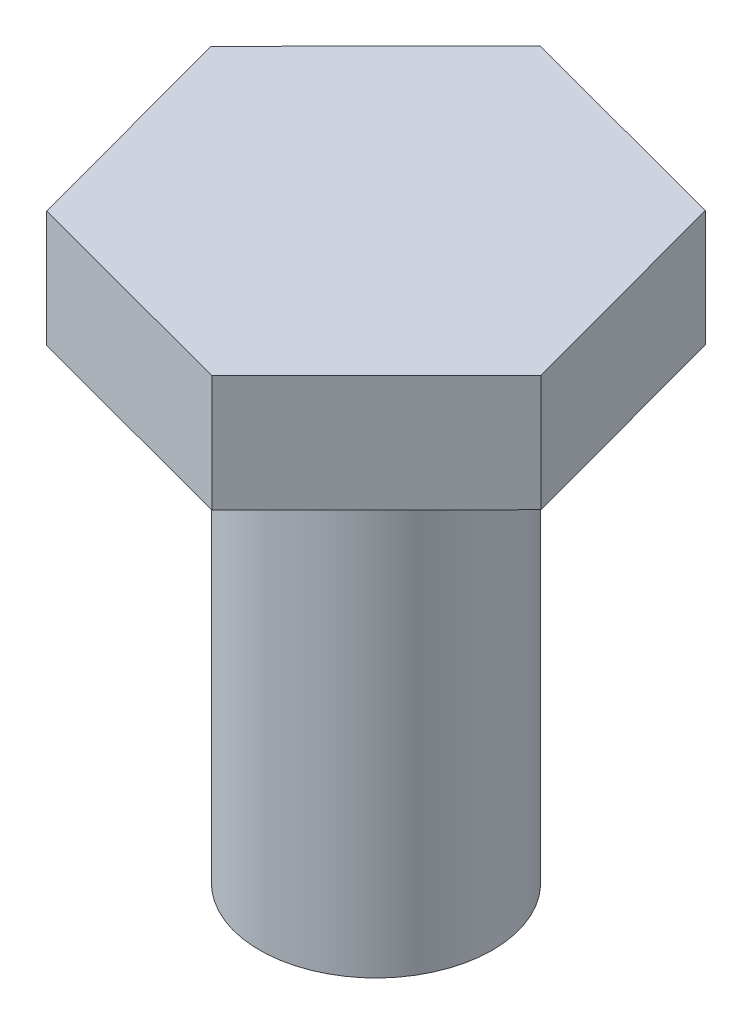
SolidWorks part; units mm, degrees
ref_plane "Front" through (0, 0, 0) normal (0, 0, 1) x (1, 0, 0)
ref_plane "Top" through (0, 0, 0) normal (0, 1, 0) x (1, 0, 0)
ref_plane "Right" through (0, 0, 0) normal (1, 0, 0) x (0, 0, -1)
sketch "Sketch1" plane through (0, 0, 0) normal (0, 0, 1) x (1, 0, 0)
  line L0 (0, 101.3677) -> (0, -91.7136) construction
  line L1 (0, -49.69) -> (25.4, -49.69)
  line L2 (25.4, -49.69) -> (25.4, 51.91)
  line L3 (25.4, 51.91) -> (50.8, 51.91)
  line L4 (50.8, 51.91) -> (50.8, 77.31)
  line L5 (50.8, 77.31) -> (0, 77.31)
  line L6 (0, 77.31) -> (0, -49.69)
  dimension "D1" = 50.8
  dimension "D2" = 101.6
  dimension "D3" = 25.4
  dimension "D4" = 127
revolve "Revolve1" add sketch "Sketch1" angle 360 about L0
sketch "Sketch2" plane through (0, 77.31, 0) normal (0, 1, 0) x (-1, 0, 0)
  line L1 (35.8608, 35.9811) -> (-13.2302, 49.0469)
  line L2 (-13.2302, 49.0469) -> (-49.091, 13.0658)
  line L3 (-49.091, 13.0658) -> (-35.8608, -35.9811)
  line L4 (-35.8608, -35.9811) -> (13.2302, -49.0469)
  line L5 (13.2302, -49.0469) -> (49.091, -13.0658)
  line L6 (49.091, -13.0658) -> (35.8608, 35.9811)
  circle A0 centre (0, 0) radius 50.8 construction
  circle A2 centre (0, 0) radius 50.8 construction
extrude "Cut-Extrude2" cut sketch "Sketch2" against normal through all flip side to cut
